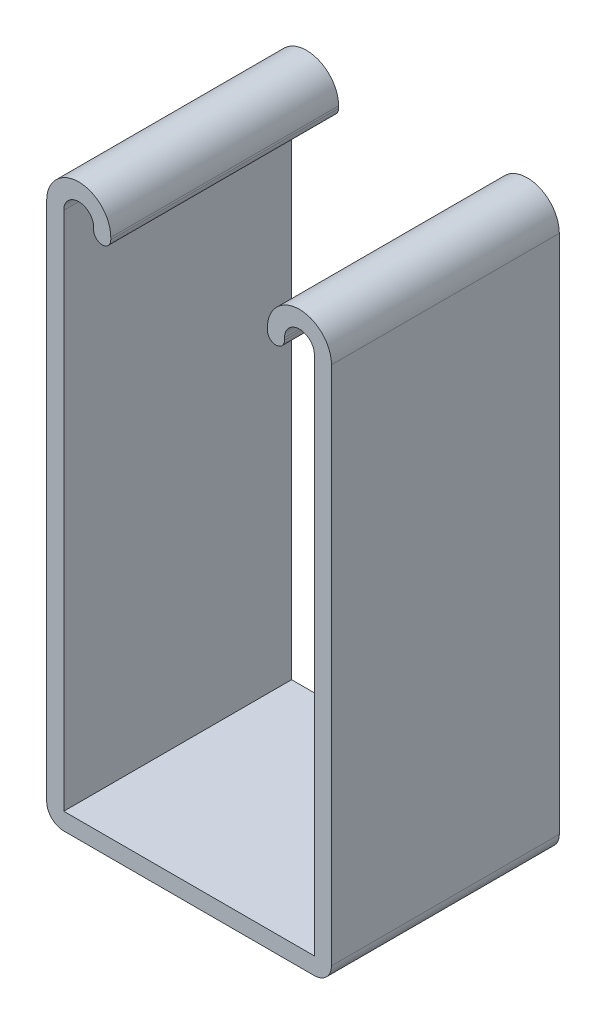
SolidWorks part; units mm, degrees
ref_plane "Plane1" through (0, 0, 0) normal (0, 0, 1) x (1, 0, 0)
ref_plane "Plane2" through (0, 0, 0) normal (0, 1, 0) x (1, 0, 0)
ref_plane "Plane3" through (0, 0, 0) normal (1, 0, 0) x (0, 0, -1)
sketch "Sketch1" plane through (0, 0, 0) normal (0, 0, 1) x (1, 0, 0)
  line L0 (-15.875, 30.6927) -> (-15.875, -27.3304)
  line L1 (-13.97, -29.2354) -> (13.97, -29.2354)
  line L2 (15.875, -27.3304) -> (15.875, 30.6927)
  line L3 (8.7312, 30.6927) -> (8.7312, 30.4546)
  line L4 (-8.7313, 30.6927) -> (-8.7313, 30.4546)
  line L5 (-10.6363, 30.6927) -> (-10.6363, 30.4546)
  line L6 (-13.97, 30.6927) -> (-13.97, -27.3304)
  line L7 (-13.97, -27.3304) -> (13.97, -27.3304)
  line L8 (13.97, -27.3304) -> (13.97, 30.6927)
  line L9 (10.6363, 30.6927) -> (10.6362, 30.4546)
  line L10 (-25.4, 34.2646) -> (25.4, 34.2646) construction
  line L11 (-12.8524, 29.5021) -> (12.8524, 29.5021) construction
  arc A0 (15.875, 30.6927) -> (8.7312, 30.6927) centre (12.3031, 30.6927) ccw
  arc A1 (-15.875, 30.6927) -> (-8.7313, 30.6927) centre (-12.3031, 30.6927) cw
  arc A2 (-13.97, -29.2354) -> (-15.875, -27.3304) centre (-13.97, -27.3304) cw
  arc A3 (13.97, -29.2354) -> (15.875, -27.3304) centre (13.97, -27.3304) ccw
  arc A4 (-13.97, 30.6927) -> (-10.6363, 30.6927) centre (-12.3031, 30.6927) cw
  arc A5 (13.97, 30.6927) -> (10.6363, 30.6927) centre (12.3031, 30.6927) ccw
  arc A6 (8.7312, 30.4546) -> (10.6362, 30.4546) centre (9.6837, 30.4546) ccw
  arc A7 (-8.7313, 30.4546) -> (-10.6363, 30.4546) centre (-9.6838, 30.4546) cw
  dimension "D1" = 1.905
  dimension "D3" = 15.875
  dimension "Width" = 31.75
  dimension "D5" = 29.2354
  dimension "D6" = 7.1437
  dimension "D7" = 17.4625
  dimension "D8" = 34.2646
  dimension "D9" = 4.7625
  dimension "gauge" = 1.905
extrude "Base-Extrude" add sketch "Sketch1" along normal mid plane 25.4
equation "\"D3@Sketch1\" = \"Width@Sketch1\" / 2"
equation "\"D7@Sketch1\" = \"Width@Sketch1\" - 2 * \"D6@Sketch1\""
equation "\"D1@Sketch1\" = \"gauge@Sketch1\""
